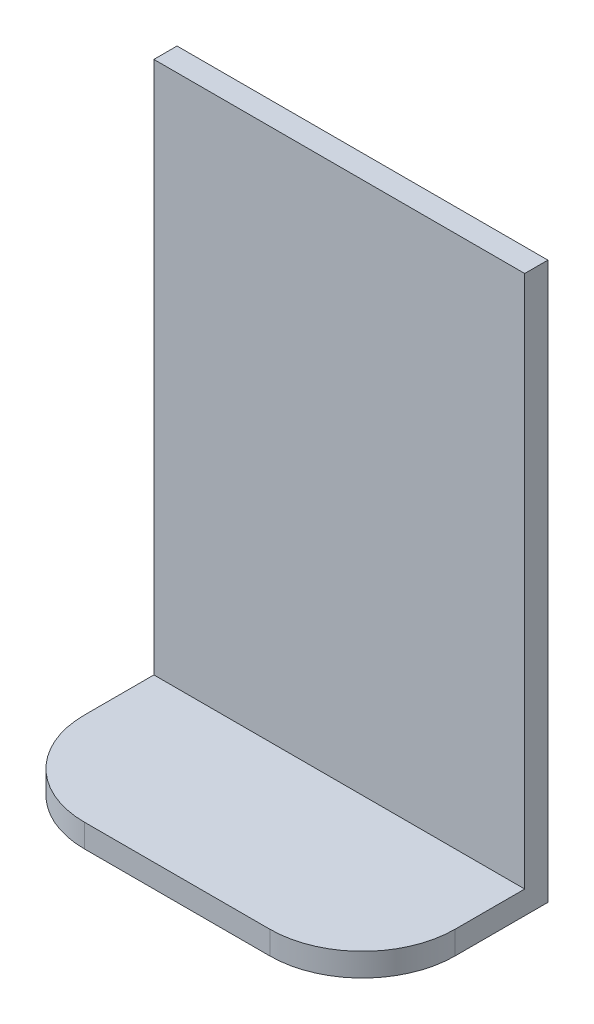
SolidWorks part; units mm, degrees
ref_plane "Front Plane" through (0, 0, 0) normal (0, 0, 1) x (1, 0, 0)
ref_plane "Top Plane" through (0, 0, 0) normal (0, 1, 0) x (1, 0, 0)
ref_plane "Right Plane" through (0, 0, 0) normal (1, 0, 0) x (0, 0, -1)
sketch "Sketch1" plane through (0, 0, 0) normal (1, 0, 0) x (0, 0, -1)
  line L0 (0, 0) -> (-25.4, 0)
  line L1 (-25.4, 0) -> (-25.4, 3.175)
  line L2 (-25.4, 3.175) -> (-3.175, 3.175)
  line L3 (-3.175, 3.175) -> (-3.175, 76.2)
  line L4 (-3.175, 76.2) -> (0, 76.2)
  line L5 (0, 76.2) -> (0, 0)
  dimension "D1" = 3.175
  dimension "D2" = 3.175
  dimension "D3" = 25.4
  dimension "D4" = 76.2
extrude "Boss-Extrude1" add sketch "Sketch1" along normal mid plane 50.8
fillet "Fillet1" radius 12.7 2 edges at (25.4, 1.5875, 25.4) (-25.4, 1.5875, 25.4)
